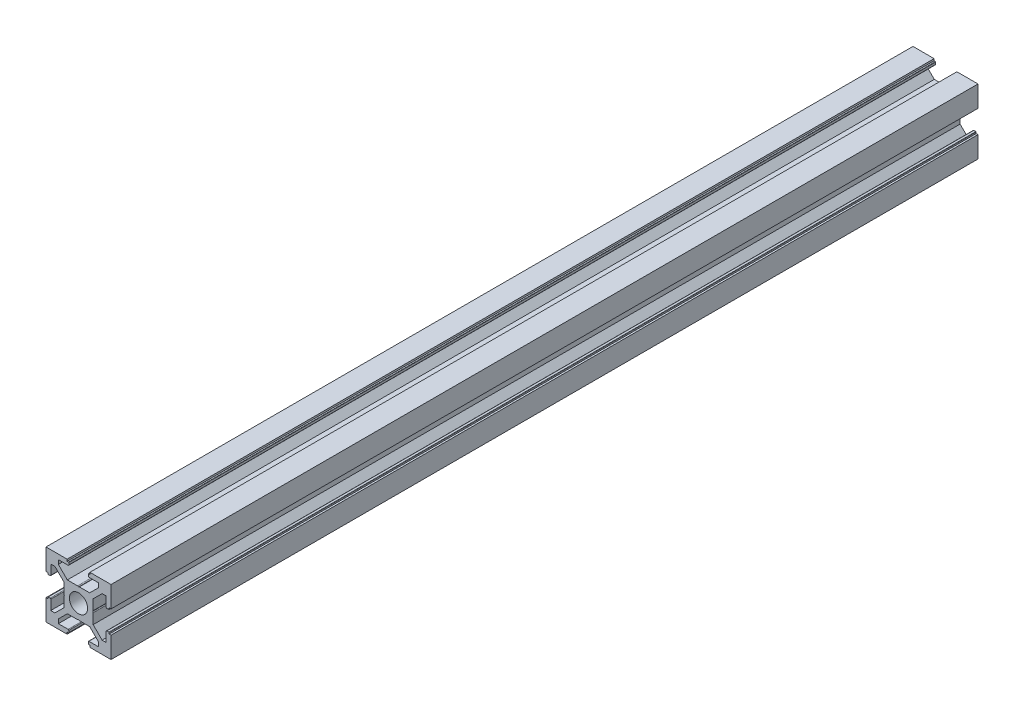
SolidWorks part; units mm, degrees
ref_plane "Alzado" through (0, 0, 0) normal (0, 0, 1) x (1, 0, 0)
ref_plane "Planta" through (0, 0, 0) normal (0, 1, 0) x (1, 0, 0)
ref_plane "Vista lateral" through (0, 0, 0) normal (1, 0, 0) x (0, 0, -1)
sketch "Croquis1" plane through (0, 0, 0) normal (0, 0, 1) x (1, 0, 0)
  line L0 (-15, 15) -> (-5.25, 15)
  line L1 (6.7045, 8.2955) -> (5.159, 6.75)
  line L8 (15, 15) -> (5.25, 15)
  line L10 (-5.25, 12.795) -> (-4.5, 12.795) construction
  line L11 (-4.5, 12.795) -> (-4.5, 14.145) construction
  line L12 (-4.65, 14.145) -> (-5.25, 14.145)
  line L13 (-5.25, 14.145) -> (-5.25, 15)
  line L15 (-9.3, 12.795) -> (-4.8, 12.795)
  line L16 (-4.5, 13.095) -> (-4.5, 13.995)
  line L20 (-9.3, 12.795) -> (-9.3, 10.891)
  line L21 (-9.3, 10.891) -> (-6.7045, 8.2955)
  line L22 (-6.7045, 8.2955) -> (-5.159, 6.75)
  line L23 (-8.2955, 6.7045) -> (-6.75, 5.159)
  line L24 (-10.891, 9.3) -> (-8.2955, 6.7045)
  line L25 (-12.795, 9.3) -> (-10.891, 9.3)
  line L26 (-12.795, 9.3) -> (-12.795, 4.8)
  line L27 (-13.095, 4.5) -> (-13.995, 4.5)
  line L28 (-14.145, 4.65) -> (-14.145, 5.25)
  line L29 (-14.145, 5.25) -> (-15, 5.25)
  line L30 (-15, 15) -> (-15, 5.25)
  line L31 (-15, -15) -> (-15, -5.25)
  line L32 (-14.145, -5.25) -> (-15, -5.25)
  line L33 (-14.145, -4.65) -> (-14.145, -5.25)
  line L34 (-13.095, -4.5) -> (-13.995, -4.5)
  line L35 (-12.795, -9.3) -> (-12.795, -4.8)
  line L36 (-12.795, -9.3) -> (-10.891, -9.3)
  line L37 (-10.891, -9.3) -> (-8.2955, -6.7045)
  line L38 (-8.2955, -6.7045) -> (-6.75, -5.159)
  line L39 (-6.7045, -8.2955) -> (-5.159, -6.75)
  line L40 (-9.3, -10.891) -> (-6.7045, -8.2955)
  line L41 (-9.3, -12.795) -> (-9.3, -10.891)
  line L42 (-9.3, -12.795) -> (-4.8, -12.795)
  line L43 (-4.5, -13.095) -> (-4.5, -13.995)
  line L44 (-4.65, -14.145) -> (-5.25, -14.145)
  line L45 (-5.25, -14.145) -> (-5.25, -15)
  line L46 (-15, -15) -> (-5.25, -15)
  line L47 (6.7045, -8.2955) -> (5.159, -6.75)
  line L51 (4.5, 12.795) -> (4.5, 14.145) construction
  line L52 (5.25, 12.795) -> (4.5, 12.795) construction
  line L55 (15, -15) -> (5.25, -15)
  line L56 (5.25, -14.145) -> (5.25, -15)
  line L57 (4.65, -14.145) -> (5.25, -14.145)
  line L58 (4.5, -13.095) -> (4.5, -13.995)
  line L59 (9.3, -12.795) -> (4.8, -12.795)
  line L60 (9.3, -12.795) -> (9.3, -10.891)
  line L61 (9.3, -10.891) -> (6.7045, -8.2955)
  line L62 (8.2955, -6.7045) -> (6.75, -5.159)
  line L63 (10.891, -9.3) -> (8.2955, -6.7045)
  line L64 (12.795, -9.3) -> (10.891, -9.3)
  line L65 (12.795, -9.3) -> (12.795, -4.8)
  line L66 (13.095, -4.5) -> (13.995, -4.5)
  line L67 (14.145, -4.65) -> (14.145, -5.25)
  line L68 (14.145, -5.25) -> (15, -5.25)
  line L69 (15, -15) -> (15, -5.25)
  line L70 (15, 15) -> (15, 5.25)
  line L71 (14.145, 5.25) -> (15, 5.25)
  line L72 (14.145, 4.65) -> (14.145, 5.25)
  line L73 (13.095, 4.5) -> (13.995, 4.5)
  line L74 (12.795, 9.3) -> (12.795, 4.8)
  line L75 (12.795, 9.3) -> (10.891, 9.3)
  line L76 (10.891, 9.3) -> (8.2955, 6.7045)
  line L77 (8.2955, 6.7045) -> (6.75, 5.159)
  line L78 (9.3, 10.891) -> (6.7045, 8.2955)
  line L79 (9.3, 12.795) -> (9.3, 10.891)
  line L80 (4.5, 13.095) -> (4.5, 13.995)
  line L81 (9.3, 12.795) -> (4.8, 12.795)
  line L82 (5.25, 14.145) -> (5.25, 15)
  line L83 (4.65, 14.145) -> (5.25, 14.145)
  line L84 (15, 15) -> (5.25, 15)
  line L87 (6.75, 0.45) -> (6.75, 5.159)
  line L88 (6.75, -0.45) -> (6.75, -5.159)
  line L89 (6.3, 0) -> (6.75, 0) construction
  line L90 (-6.75, -0.45) -> (-6.75, -5.159)
  line L91 (-6.75, 0.45) -> (-6.75, 5.159)
  line L94 (5.159, 6.75) -> (0.45, 6.75)
  line L95 (-5.159, 6.75) -> (-0.45, 6.75)
  line L96 (5.159, -6.75) -> (0.45, -6.75)
  line L97 (-5.159, -6.75) -> (-0.45, -6.75)
  arc A0 (-4.5, 13.995) -> (-4.65, 14.145) centre (-4.65, 13.995) ccw
  arc A1 (-4.8, 12.795) -> (-4.5, 13.095) centre (-4.8, 13.095) ccw
  arc A2 (-12.795, 4.8) -> (-13.095, 4.5) centre (-13.095, 4.8) cw
  arc A3 (-13.995, 4.5) -> (-14.145, 4.65) centre (-13.995, 4.65) cw
  arc A4 (-13.995, -4.5) -> (-14.145, -4.65) centre (-13.995, -4.65) ccw
  arc A5 (-12.795, -4.8) -> (-13.095, -4.5) centre (-13.095, -4.8) ccw
  arc A6 (-4.8, -12.795) -> (-4.5, -13.095) centre (-4.8, -13.095) cw
  arc A7 (-4.5, -13.995) -> (-4.65, -14.145) centre (-4.65, -13.995) cw
  arc A8 (4.5, -13.995) -> (4.65, -14.145) centre (4.65, -13.995) ccw
  arc A9 (4.8, -12.795) -> (4.5, -13.095) centre (4.8, -13.095) ccw
  arc A10 (12.795, -4.8) -> (13.095, -4.5) centre (13.095, -4.8) cw
  arc A11 (13.995, -4.5) -> (14.145, -4.65) centre (13.995, -4.65) cw
  arc A12 (13.995, 4.5) -> (14.145, 4.65) centre (13.995, 4.65) ccw
  arc A13 (12.795, 4.8) -> (13.095, 4.5) centre (13.095, 4.8) ccw
  arc A14 (4.8, 12.795) -> (4.5, 13.095) centre (4.8, 13.095) cw
  arc A15 (4.5, 13.995) -> (4.65, 14.145) centre (4.65, 13.995) cw
  circle A16 centre (0, 0) radius 4.2
  arc A17 (6.75, 0.45) -> (6.3, 0) centre (6.3, 0.45) cw
  arc A18 (6.75, -0.45) -> (6.3, 0) centre (6.3, -0.45) ccw
  arc A19 (-6.75, -0.45) -> (-6.3, 0) centre (-6.3, -0.45) cw
  arc A20 (-6.75, 0.45) -> (-6.3, 0) centre (-6.3, 0.45) ccw
  arc A21 (-0.45, 6.75) -> (0, 6.3) centre (-0.45, 6.3) cw
  arc A22 (0.45, 6.75) -> (0, 6.3) centre (0.45, 6.3) ccw
  arc A23 (-0.45, -6.75) -> (0, -6.3) centre (-0.45, -6.3) ccw
  arc A24 (0.45, -6.75) -> (0, -6.3) centre (0.45, -6.3) cw
  point P4 (15, 0)
  point P5 (0, 15)
extrude "Extruir1" add sketch "Croquis1" along normal blind 400
